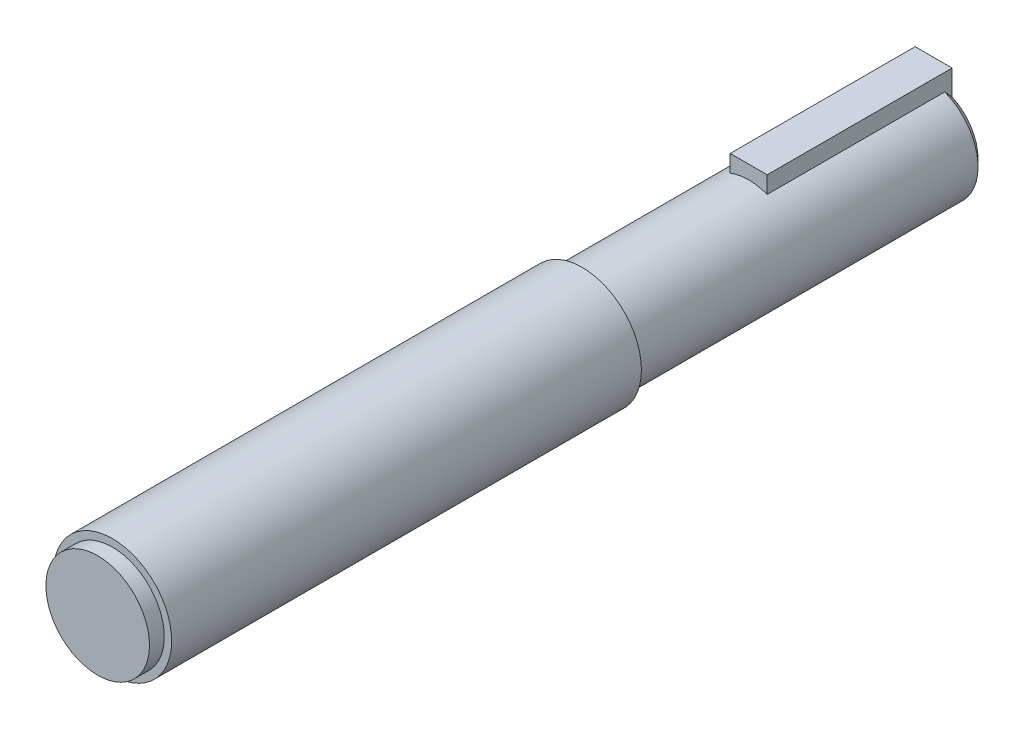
SolidWorks part; units mm, degrees
ref_plane "前视" through (0, 0, 0) normal (0, 0, 1) x (1, 0, 0)
ref_plane "上视" through (0, 0, 0) normal (0, 1, 0) x (1, 0, 0)
ref_plane "右视" through (0, 0, 0) normal (1, 0, 0) x (0, 0, -1)
sketch "草图1" plane through (0, 0, 0) normal (0, 0, 1) x (1, 0, 0)
  circle A0 centre (0, 0) radius 7
extrude "凸台-拉伸1" add sketch "草图1" along normal blind 47.5
sketch "草图2" plane through (0, 0, 47.5) normal (0, 0, 1) x (1, 0, 0)
  circle A0 centre (0, 0) radius 8
extrude "凸台-拉伸2" add sketch "草图2" along normal blind 63.5
sketch "草图3" plane through (0, 0, 0) normal (0, 0, -1) x (-1, 0, 0)
  line L2 (-2.5, 6.5383) -> (-2.5, 3.8383)
  line L3 (2.5, 6.5383) -> (2.5, 3.8383)
  line L4 (2.5, 3.8383) -> (-2.5, 3.8383)
  arc A0 (2.5, 6.5383) -> (-2.5, 6.5383) centre (0, 0) ccw
  dimension "D2" = 2.7
extrude "切除-拉伸1" cut sketch "草图3" against normal blind 25
sketch "草图4" plane through (0, 0, 0) normal (0, 0, -1) x (-1, 0, 0)
  line L1 (-2.5, 3.8383) -> (2.5, 3.8383)
  line L2 (-2.5, 3.8383) -> (-2.5, 8.8383)
  line L3 (-2.5, 8.8383) -> (2.5, 8.8383)
  line L4 (2.5, 3.8383) -> (2.5, 8.8383)
  dimension "D1" = 5
  dimension "D2" = 5
extrude "凸台-拉伸3" add sketch "草图4" against normal blind 25
sketch "草图5" plane through (0, 0, 111) normal (0, 0, 1) x (1, 0, 0)
  circle A0 centre (0, 0) radius 7
extrude "凸台-拉伸4" add sketch "草图5" along normal blind 2
chamfer "倒角1" distance 1 angle 45 1 edges at (0, -7, 0)
